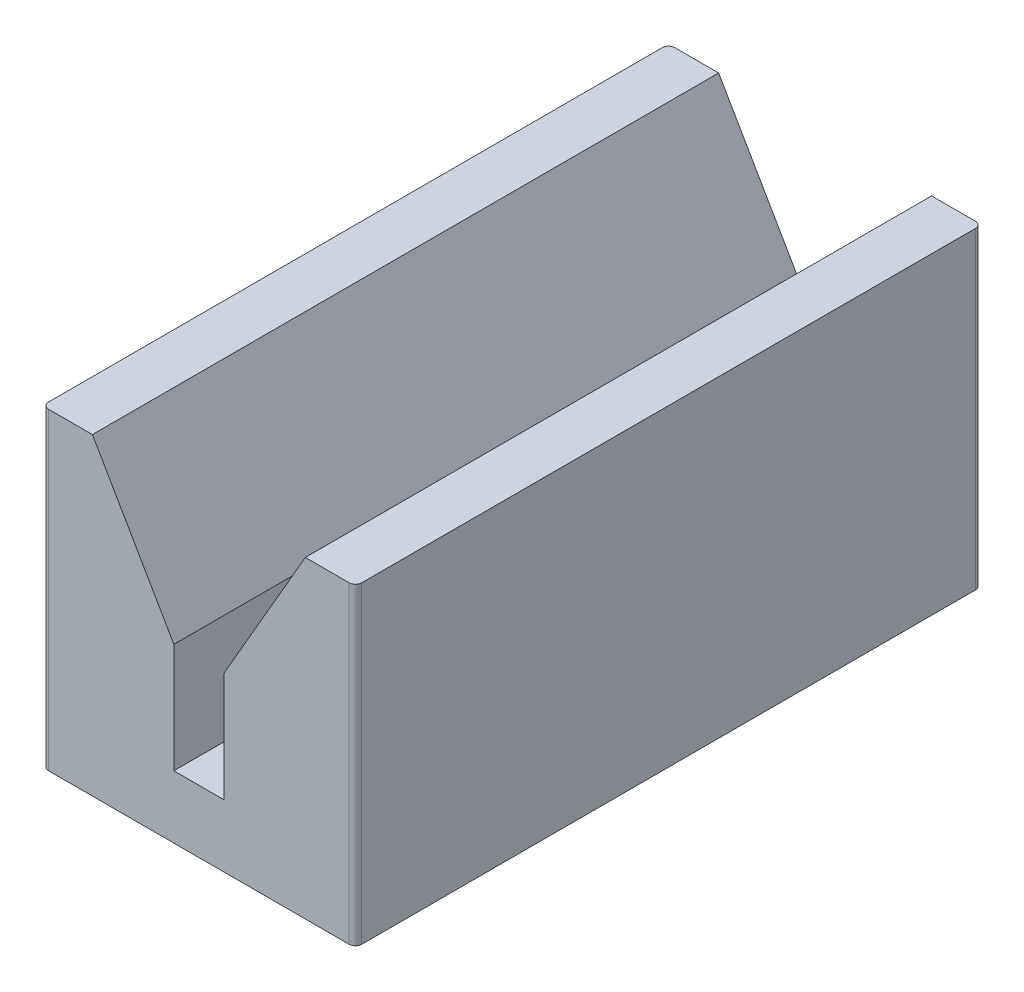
SolidWorks part; units mm, degrees
ref_plane "Plan de face" through (0, 0, 0) normal (0, 0, 1) x (1, 0, 0)
ref_plane "Plan de dessus" through (0, 0, 0) normal (0, 1, 0) x (1, 0, 0)
ref_plane "Plan de droite" through (0, 0, 0) normal (1, 0, 0) x (0, 0, -1)
sketch "Esquisse1" plane through (0, 0, 0) normal (0, 1, 0) x (1, 0, 0)
  line L0 (0, -20.2628) -> (0, 58.4186) construction
  line L1 (-24.3225, 0) -> (29.7425, 0) construction
  line L2 (25, -20.2628) -> (25, 58.4186) construction
  line L3 (-24.3225, 50) -> (34.6841, 50) construction
  line L4 (4, 55.6667) -> (4, -3.7395) construction
  line L5 (-3.5126, 49) -> (27.2256, 49) construction
  line L6 (-17.7609, 25) -> (23.5775, 25) construction
  line L7 (12.5, 55.6667) -> (12.5, -13.5587) construction
  line L8 (0.5, 50) -> (24.5, 50)
  line L9 (21, 55.6667) -> (21, -3.7395) construction
  line L10 (-3.5126, 1) -> (27.2256, 1) construction
  line L11 (0.5, 0) -> (24.5, 0)
  line L20 (0, 49.5) -> (0, 0.5)
  line L22 (25, 49.5) -> (25, 0.5)
  arc A0 (0.5, 50) -> (0, 49.5) centre (0.5, 49.5) ccw
  arc A1 (24.5, 50) -> (25, 49.5) centre (24.5, 49.5) cw
  arc A2 (24.5, 0) -> (25, 0.5) centre (24.5, 0.5) ccw
  arc A3 (0, 0.5) -> (0.5, 0) centre (0.5, 0.5) ccw
  dimension "D6" = 0.5
  dimension "D1" = 25
  dimension "D2" = 50
  dimension "D3" = 25
  dimension "D4" = 12.5
  dimension "D5" = 4
  dimension "D7" = 1
extrude "Extrusion1" add sketch "Esquisse1" along normal blind 25
sketch "Esquisse2" plane through (0, 0, 0) normal (0, 0, 1) x (1, 0, 0)
  line L0 (-2.753, 0) -> (35.6352, 0) construction
  line L1 (0, -3.6904) -> (0, 33.6054) construction
  line L2 (12.5, 33.6054) -> (12.5, -3.6904) construction
  line L3 (-2.753, 5) -> (35.6352, 5) construction
  line L4 (4, 30.1696) -> (4, 22.0012) construction
  line L5 (14.7853, 6.3194) -> (4, 25) construction
  line L6 (10.5, 17.5712) -> (10.5, 2.5405) construction
  line L7 (10.5, 5) -> (10.5, 13.7417)
  line L8 (10.5, 13.7417) -> (4, 25)
  line L9 (14.5, 5) -> (14.5, 13.7417)
  line L10 (14.5, 13.7417) -> (21, 25)
  line L11 (10.5, 5) -> (14.5, 5)
  line L12 (21, 25) -> (4, 25)
  dimension "D1" = 12.5
  dimension "D2" = 5
  dimension "D3" = 4
  dimension "D4" = 30
  dimension "D5" = 2
extrude "Enlèv. mat.-Extru.1" cut sketch "Esquisse2" against normal through all
